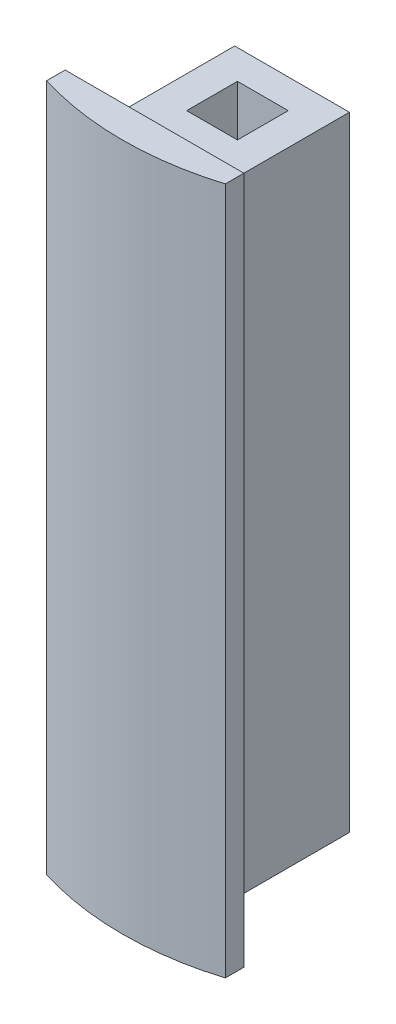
SolidWorks part; units mm, degrees
ref_plane "Front Plane" through (0, 0, 0) normal (0, 0, 1) x (1, 0, 0)
ref_plane "Top Plane" through (0, 0, 0) normal (0, 1, 0) x (1, 0, 0)
ref_plane "Right Plane" through (0, 0, 0) normal (1, 0, 0) x (0, 0, -1)
sketch "Sketch2" plane through (0, 0, 0) normal (0, 1, 0) x (1, 0, 0)
  circle A0 centre (0, 0) radius 19
  dimension "D1" = 38
ref_plane "Plane1" through (0, 0, 19) normal (0, 0, 1) x (1, 0, 0)
sketch "Sketch3" plane through (0, 0, 19) normal (0, 0, 1) x (1, 0, 0)
  line L1 (5.5875, 21.5) -> (-5.5875, 21.5)
  line L2 (5.5875, 21.5) -> (5.5875, -21.5)
  line L3 (5.5875, -21.5) -> (-5.5875, -21.5)
  line L4 (-5.5875, 21.5) -> (-5.5875, -21.5)
  line L5 (5.5875, 21.5) -> (-5.5875, -21.5) construction
  line L6 (5.5875, -21.5) -> (-5.5875, 21.5) construction
  point P0 (0, 0)
  dimension "D1" = 43
  dimension "D2" = 11.175
extrude "Boss-Extrude1" add sketch "Sketch3" against normal blind 2 contours L4 L3 L2 L1
extrude "Cut-Extrude3" cut sketch "Sketch2" against normal mid plane 61 flip side to cut contours A0
ref_plane "Plane2" through (0, 0, 17) normal (0, 0, -1) x (-1, 0, 0)
sketch "Sketch4" plane through (0, 0, 17) normal (0, 0, -1) x (-1, 0, 0)
  line L0 (5.5875, 21.5) -> (5.5875, -21.5) construction
  line L1 (3.5875, -19.5) -> (-3.5875, -19.5)
  line L2 (3.5875, -19.5) -> (3.5875, 19.5)
  line L3 (3.5875, 19.5) -> (-3.5875, 19.5)
  line L4 (-3.5875, -19.5) -> (-3.5875, 19.5)
  line L5 (3.5875, -19.5) -> (-3.5875, 19.5) construction
  line L6 (3.5875, 19.5) -> (-3.5875, -19.5) construction
  line L7 (-5.5875, 21.5) -> (5.5875, 21.5) construction
  point P0 (0, 0)
  dimension "D1" = 2
  dimension "D2" = 2
extrude "Boss-Extrude2" add sketch "Sketch4" along normal blind 8.6
sketch "Sketch8" plane through (0, 19.5, 0) normal (0, 1, 0) x (1, 0, 0)
  line L0 (0, -17) -> (0, -13.4) construction
  line L1 (5.5875, -17) -> (-5.5875, -17) construction
  line L4 (-1.5875, -13.4) -> (1.5875, -13.4)
  line L5 (-1.5875, -13.4) -> (-1.5875, -10.225)
  line L6 (-1.5875, -10.225) -> (1.5875, -10.225)
  line L7 (1.5875, -13.4) -> (1.5875, -10.225)
  point P13 (0, -13.4)
  dimension "D1" = 3.6
  dimension "D2" = 3.175
  dimension "D3" = 3.175
extrude "Cut-Extrude4" cut sketch "Sketch8" against normal blind 37 contours L6 L7 L4 L5
sketch "Sketch9" plane through (0, 0, 8.4) normal (0, 0, -1) x (-1, 0, 0)
  line L0 (0, -19.5) -> (0, -13.5) construction
  line L1 (-3.5875, -19.5) -> (3.5875, -19.5) construction
  line L3 (1.5875, -11.9125) -> (-1.5875, -11.9125)
  line L4 (1.5875, -11.9125) -> (1.5875, -15.0875)
  line L5 (1.5875, -15.0875) -> (-1.5875, -15.0875)
  line L6 (-1.5875, -11.9125) -> (-1.5875, -15.0875)
  line L7 (1.5875, -11.9125) -> (-1.5875, -15.0875) construction
  line L8 (1.5875, -15.0875) -> (-1.5875, -11.9125) construction
  dimension "D1" = 6
  dimension "D2" = 3.175
extrude "Cut-Extrude5" cut sketch "Sketch9" against normal up to next
